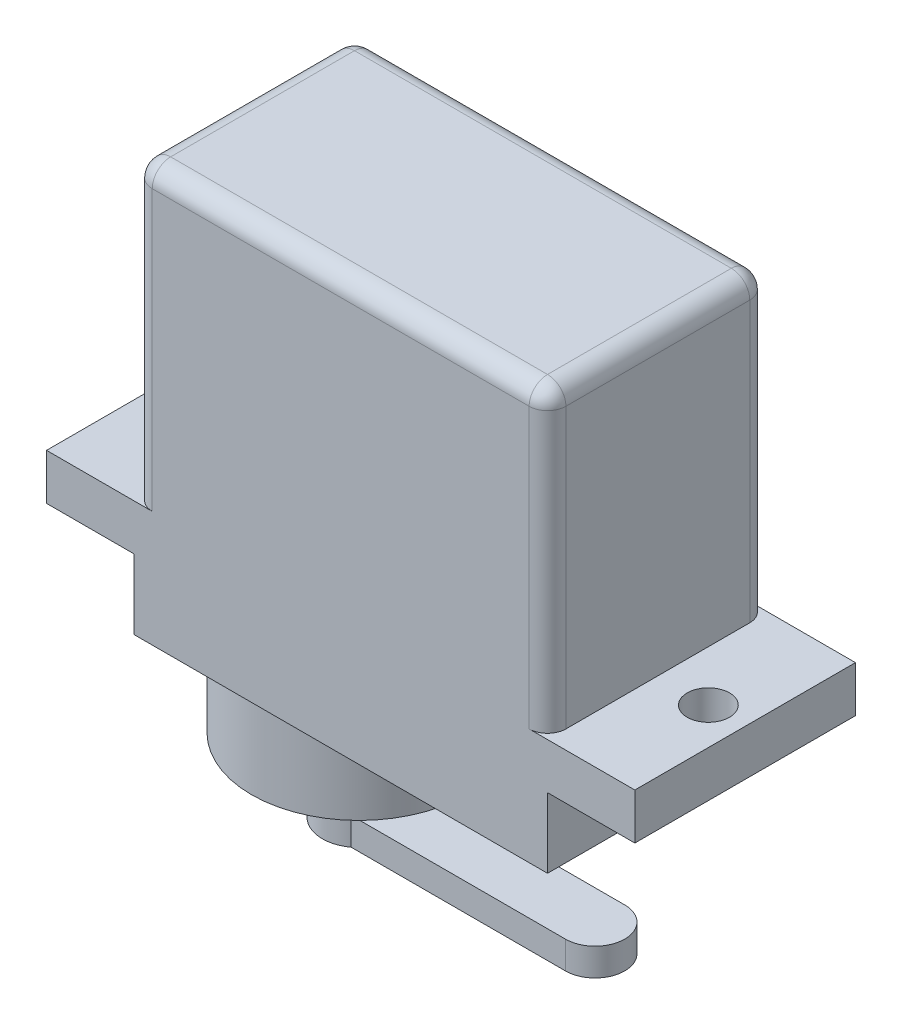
SolidWorks part; units mm, degrees
ref_plane "前视" through (0, 0, 0) normal (0, 0, 1) x (1, 0, 0)
ref_plane "上视" through (0, 0, 0) normal (0, 1, 0) x (1, 0, 0)
ref_plane "右视" through (0, 0, 0) normal (1, 0, 0) x (0, 0, -1)
sketch "草图1" plane through (0, 0, 0) normal (0, 0, 1) x (1, 0, 0)
  line L0 (0, 0) -> (0, 61.6949) construction
  line L1 (0, 0) -> (-11.25, 0)
  line L2 (-11.25, 0) -> (-11.25, 3.8)
  line L3 (-11.25, 3.8) -> (-16, 3.8)
  line L4 (-16, 3.8) -> (-16, 6.3)
  line L5 (-16, 6.3) -> (-11.25, 6.3)
  line L6 (-11.25, 6.3) -> (-11.25, 22.5)
  line L7 (-11.25, 22.5) -> (11.25, 22.5)
  line L8 (11.25, 22.5) -> (11.25, 6.3)
  line L9 (11.25, 6.3) -> (16, 6.3)
  line L10 (16, 6.3) -> (16, 3.8)
  line L11 (16, 3.8) -> (11.25, 3.8)
  line L12 (11.25, 3.8) -> (11.25, 0)
  line L13 (11.25, 0) -> (0, 0)
  point P5 (0, 1.1024)
  dimension "D1" = 22.5
  dimension "D2" = 3.8
  dimension "D3" = 2.5
  dimension "D4" = 32
  dimension "D5" = 22.5
extrude "凸台-拉伸1" add sketch "草图1" along normal mid plane 12
sketch "草图2" plane through (0, 3.8, 0) normal (0, -1, 0) x (1, 0, 0)
  line L0 (-16, 0) -> (16, 0) construction
  line L1 (-16, 6) -> (-16, -6) construction
  line L2 (16, 6) -> (16, -6) construction
  line L3 (0, 0) -> (0, 8.3558) construction
  circle A0 centre (-14, 0) radius 1.15
  circle A1 centre (14, 0) radius 1.15
  dimension "D1" = 28
  dimension "D2" = 2.3
extrude "切除-拉伸1" cut sketch "草图2" against normal through all
sketch "草图3" plane through (0, 0, 0) normal (0, -1, 0) x (1, 0, 0)
  line L0 (0, 0) -> (-11.25, 0) construction
  line L1 (-11.25, 6) -> (-11.25, -6) construction
  circle A0 centre (-5, 0) radius 5.85
  point P7 (-6.1165, 0)
  dimension "D1" = 11.7
  dimension "D2" = 5
extrude "凸台-拉伸2" add sketch "草图3" along normal blind 4.5
sketch "草图4" plane through (0, -4.5, 0) normal (0, -1, 0) x (1, 0, 0)
  circle A0 centre (-5, 0) radius 2
  dimension "D1" = 4
extrude "凸台-拉伸3" add sketch "草图4" along normal blind 4
sketch "草图5" plane through (0, -8.5, 0) normal (0, -1, 0) x (1, 0, 0)
  line L0 (-5, 0) -> (7.8379, 0) construction
  line L1 (-5, 1.6115) -> (7.8379, 1.6115)
  line L2 (-5, -1.6115) -> (7.8379, -1.6115)
  arc A0 (-5, 1.6115) -> (-5, -1.6115) centre (-5, 0) ccw
  arc A1 (7.8379, -1.6115) -> (7.8379, 1.6115) centre (7.8379, 0) ccw
  point P4 (1.419, 0)
extrude "凸台-拉伸4" add sketch "草图5" against normal blind 1.5
fillet "圆角1" radius 1 8 edges at (11.25, 22.5, 0) (0, 22.5, 6) (-11.25, 22.5, 0) (0, 22.5, -6) (-11.25, 14.4, -6) (11.25, 14.4, -6) (11.25, 14.4, 6) (-11.25, 14.4, 6)
